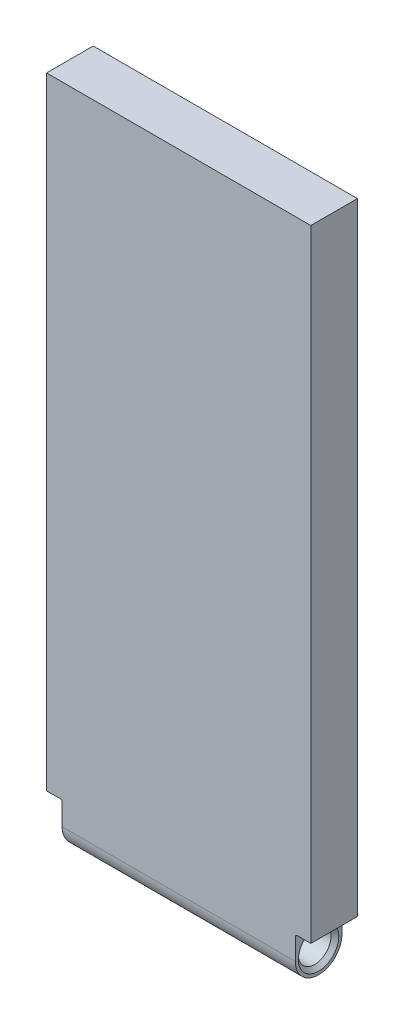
SolidWorks part; units mm, degrees
ref_plane "前视基准面" through (0, 0, 0) normal (0, 0, 1) x (1, 0, 0)
ref_plane "上视基准面" through (0, 0, 0) normal (0, 1, 0) x (1, 0, 0)
ref_plane "右视基准面" through (0, 0, 0) normal (1, 0, 0) x (0, 0, -1)
sketch "草图1" plane through (0, 0, 0) normal (0, 0, 1) x (1, 0, 0)
  line L0 (0, 120.8119) -> (0, -25.4047) construction
  line L2 (-17, 80) -> (17, 80)
  line L3 (-17, 80) -> (-17, 0)
  line L4 (-17, 0) -> (17, 0)
  line L5 (17, 80) -> (17, 0)
  dimension "D1" = 80
  dimension "D2" = 34
extrude "凸台-拉伸1" add sketch "草图1" against normal blind 7
sketch "草图2" plane through (0, 0, -7) normal (0, 0, -1) x (-1, 0, 0)
  line L0 (17, 80) -> (17, 0) construction
  line L1 (-17, 80) -> (-15, 80)
  line L2 (-17, 80) -> (-17, 0)
  line L3 (-17, 0) -> (-15, 0)
  line L4 (17, 80) -> (17, 0)
  line L5 (-15, 80) -> (-15, 0)
  line L6 (15, 80) -> (15, 0)
  line L7 (15, 80) -> (17, 80)
  line L8 (15, 0) -> (17, 0)
  line L9 (17, 0) -> (-17, 0) construction
  dimension "D1" = 2
  dimension "D2" = 2
extrude "切除-拉伸1" cut sketch "草图2" against normal blind 1
sketch "草图3" plane through (0, 0, 0) normal (1, 0, 0) x (0, 0, -1)
  line L1 (0, 0) -> (6, 0) construction
  line L2 (0, 0) -> (0, -6) construction
  line L3 (0, -6) -> (6, -6) construction
  line L4 (6, 0) -> (6, -6) construction
  line L5 (6, 0) -> (0, -6) construction
  line L6 (0, 0) -> (6, -6) construction
  line L7 (0, 0) -> (0, -3)
  line L8 (0, 0) -> (6, 0)
  line L9 (6, 0) -> (6, -3)
  line L11 (6, 80) -> (6, 0) construction
  circle A0 centre (3, -3) radius 2.1
  arc A1 (0, -3) -> (6, -3) centre (3, -3) ccw
  dimension "D2" = 4.2
  dimension "D1" = 6
extrude "凸台-拉伸2" add sketch "草图3" along normal mid plane 30
sketch "草图5" plane through (0, 0, -7) normal (0, 0, -1) x (-1, 0, 0)
  line L4 (-15, 0) -> (15, 0)
  line L5 (15, 0) -> (15, 80)
  line L6 (15, 80) -> (-15, 80)
  line L7 (-15, 80) -> (-15, 0)
  line L8 (-15, 0) -> (15, 0)
  line L9 (15, 0) -> (15, 80)
  line L10 (15, 80) -> (-15, 80)
  line L11 (-15, 80) -> (-15, 0)
  dimension "D1" = 0
extrude "切除-拉伸2" cut sketch "草图5" against normal blind 1
fillet "圆角1" radius 0.25 2 edges
chamfer "倒角1" distance 0.5 angle 45 2 edges at (-15, -3, -5.1) (15, -3, -5.1)
